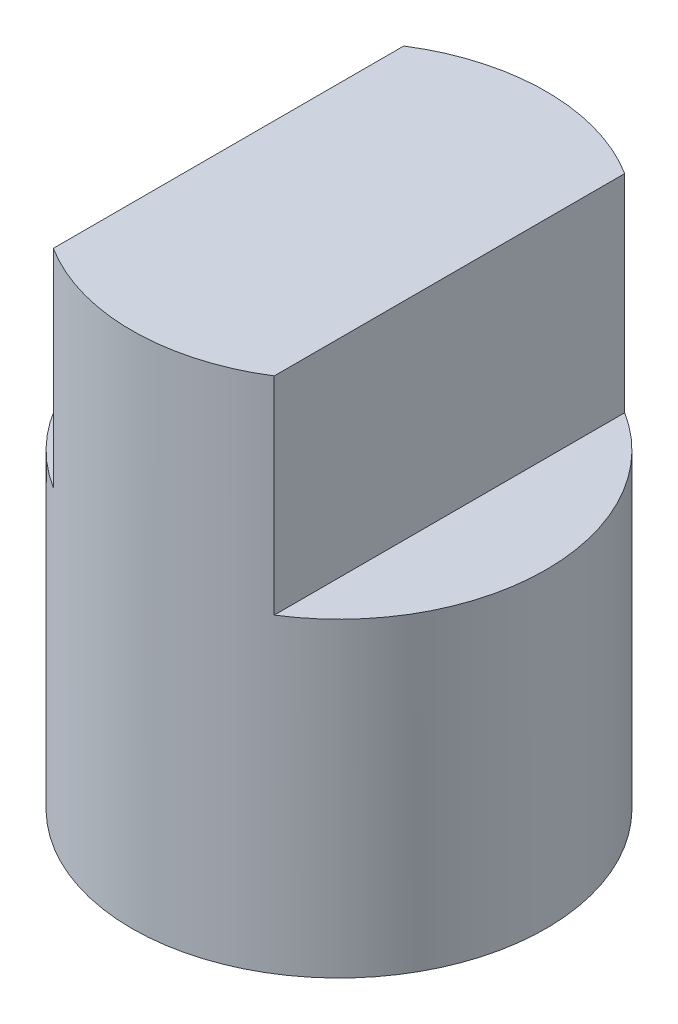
SolidWorks part; units mm, degrees
ref_plane "前视基准面" through (0, 0, 0) normal (0, 0, 1) x (1, 0, 0)
ref_plane "上视基准面" through (0, 0, 0) normal (0, 1, 0) x (1, 0, 0)
ref_plane "右视基准面" through (0, 0, 0) normal (1, 0, 0) x (0, 0, -1)
sketch "草图1" plane through (0, 0, 0) normal (0, 1, 0) x (1, 0, 0)
  circle A0 centre (0, 0) radius 30
  dimension "D1" = 60
extrude "拉伸1" add sketch "草图1" along normal blind 75
sketch "草图2" plane through (0, 75, 0) normal (0, 1, 0) x (1, 0, 0)
  line L0 (-16, -25.3772) -> (-16, 25.3772)
  line L1 (16, 25.3772) -> (16, -25.3772)
  line L2 (0, -54.7492) -> (0, 49.3514) construction
  arc A0 (16, -25.3772) -> (16, 25.3772) centre (0, 0) ccw
  circle A1 centre (0, 0) radius 30
  arc A2 (-16, 25.3772) -> (-16, -25.3772) centre (0, 0) ccw
  dimension "D2" = 32
  dimension "D1" = 0
extrude "切除-拉伸1" cut sketch "草图2" against normal blind 30
